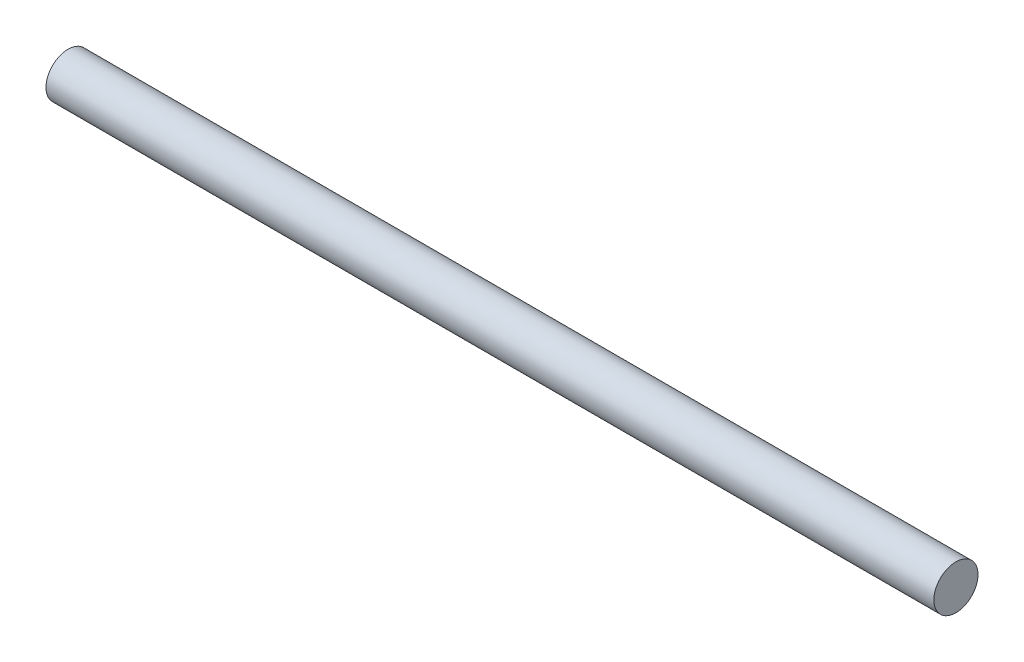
SolidWorks part; units mm, degrees
ref_plane "Plan de face" through (0, 0, 0) normal (0, 0, 1) x (1, 0, 0)
ref_plane "Plan de dessus" through (0, 0, 0) normal (0, 1, 0) x (1, 0, 0)
ref_plane "Plan de droite" through (0, 0, 0) normal (1, 0, 0) x (0, 0, -1)
sketch "Esquisse1" plane through (0, 0, 0) normal (0, 0, 1) x (1, 0, 0)
  line L0 (0, 0) -> (-201, 0)
  line L1 (-201, 0) -> (-201, 5)
  line L2 (-201, 5) -> (0, 5)
  line L3 (0, 5) -> (0, 8)
  line L4 (0, 8) -> (-1, 8)
  line L5 (-1, 8) -> (-1, 11.5)
  line L6 (-1, 11.5) -> (34, 11.5)
  line L7 (237, 11.5) -> (237, 0)
  line L8 (237, 0) -> (0, 0)
  line L9 (34, 11.5) -> (34, 11)
  line L10 (34, 11) -> (35.5, 11)
  line L11 (35.5, 11) -> (35.5, 11.5)
  line L12 (35.5, 11.5) -> (237, 11.5)
  dimension "D1" = 5
  dimension "D2" = 11.5
  dimension "D3" = 200
  dimension "D4" = 201
  dimension "D5" = 3.5
  dimension "D6" = 438
  dimension "D7" = 0.5
  dimension "D8" = 1.5
  dimension "D9" = 35
revolve "Révolution1" add sketch "Esquisse1" angle 360 mid plane about L0
fillet "Congé1" radius 2 2 edges at (-1, 11.5, 0) (237, 11.5, 0)
sketch "Esquisse2" plane through (0, 0, 0) normal (-1, 0, 0) x (0, 0, 1)
  circle A1 centre (0, 0) radius 8
  circle A2 centre (0, 0) radius 8
  dimension "D1" = 0
extrude "Enlèv. mat.-Extru.1" cut sketch "Esquisse2" against normal blind 500
